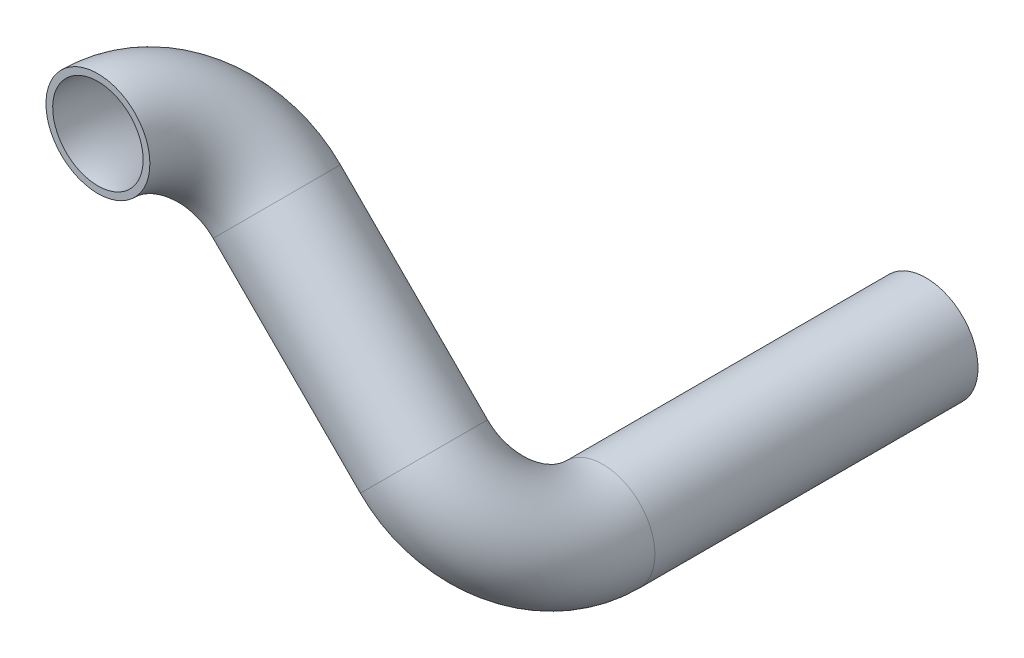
SolidWorks part; units mm, degrees
ref_plane "Front" through (0, 0, 0) normal (0, 0, 1) x (1, 0, 0)
ref_plane "Top" through (0, 0, 0) normal (0, 1, 0) x (1, 0, 0)
ref_plane "Side" through (0, 0, 0) normal (1, 0, 0) x (0, 0, -1)
sketch "PipeSketch"
  dimension "OuterDiameter" = 60.452
  dimension "InnerDiameter" = 52.6288
extrude "Extrusion" add sketch "PipeSketch" along normal blind 187.9471
sketch "FilterSketch" plane through (0, 0, 0) normal (0, 0, 1) x (1, 0, 0)
  circle A0 centre (0, 0) radius 25.4 construction
  dimension "NominalDiameter" = 50.8
sketch "Sketch1" plane through (0, 0, 187.9471) normal (0, 0, 1) x (1, 0, 0)
  line L0 (-43.1052, 43.1052) -> (-86.2105, 0) construction
  circle A0 centre (0, 0) radius 30.226 construction
  circle A1 centre (0, 0) radius 26.3144 construction
  circle A2 centre (0, 0) radius 30.226
  circle A3 centre (0, 0) radius 26.3144
revolve "Revolve1" add sketch "Sketch1" angle 90 about L0
sketch "Sketch2" plane through (-43.1052, 43.1052, 0) normal (-0.7071, 0.7071, 0) x (-0.7071, -0.7071, 0)
  circle A0 centre (0, 248.9071) radius 26.3144 construction
  circle A1 centre (0, 248.9071) radius 30.226 construction
  circle A2 centre (0, 248.9071) radius 26.3144
  circle A3 centre (0, 248.9071) radius 30.226
extrude "Extrude1" add sketch "Sketch2" along normal blind 121.0826
sketch "Sketch3" plane through (-128.7236, 128.7236, 0) normal (-0.7071, 0.7071, 0) x (-0.7071, -0.7071, 0)
  line L0 (0, 309.8671) -> (-60.96, 309.8671) construction
  circle A0 centre (0, 248.9071) radius 30.226 construction
  circle A1 centre (0, 248.9071) radius 26.3144 construction
  circle A2 centre (0, 248.9071) radius 30.226
  circle A3 centre (0, 248.9071) radius 26.3144
revolve "Revolve2" add sketch "Sketch3" angle 90 about L0
